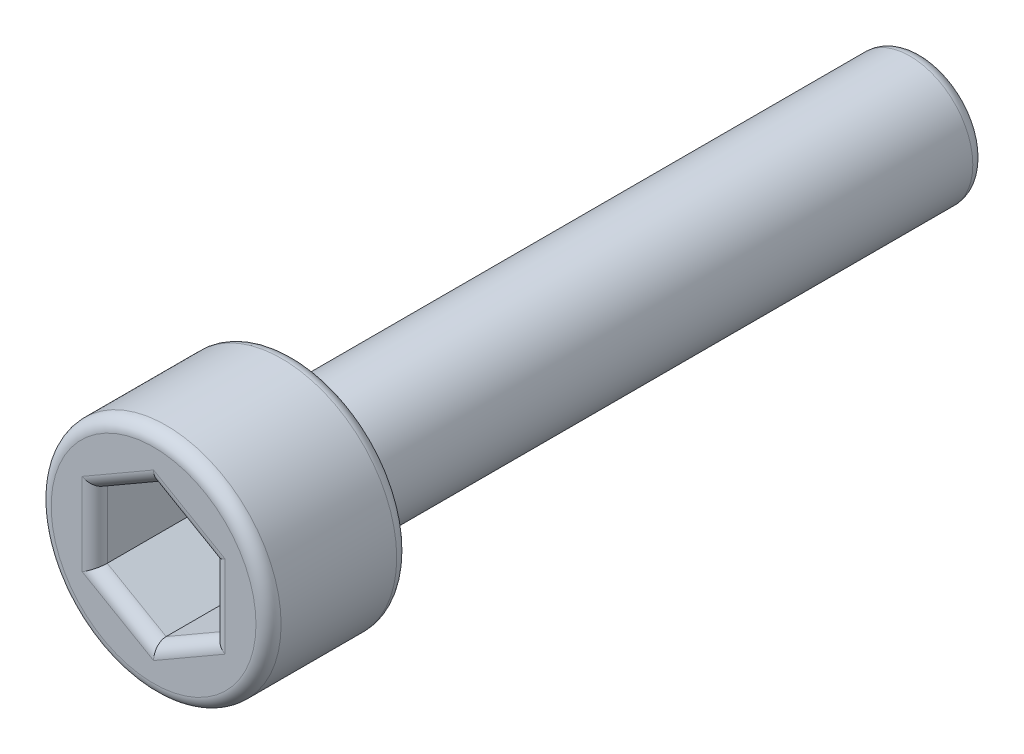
SolidWorks part; units mm, degrees
ref_plane "Front Plane" through (0, 0, 0) normal (0, 0, 1) x (1, 0, 0)
ref_plane "Top Plane" through (0, 0, 0) normal (0, 1, 0) x (1, 0, 0)
ref_plane "Right Plane" through (0, 0, 0) normal (1, 0, 0) x (0, 0, -1)
sketch "Sketch1" plane through (0, 0, 0) normal (0, 0, 1) x (1, 0, 0)
  circle A0 centre (0, 0) radius 1.27
  dimension "D1" = 2.54
extrude "Extrude1" add sketch "Sketch1" along normal blind 12.7
sketch "Sketch2" plane through (0, 0, 12.7) normal (0, 0, 1) x (1, 0, 0)
  circle A0 centre (0, 0) radius 2.3241
  dimension "D1" = 4.6482
extrude "Extrude2" add sketch "Sketch2" along normal blind 2.8448
sketch "Sketch3" plane through (0, 0, 15.5448) normal (0, 0, 1) x (1, 0, 0)
  line L1 (0, -1.3748) -> (1.1906, -0.6874)
  line L2 (1.1906, -0.6874) -> (1.1906, 0.6874)
  line L3 (1.1906, 0.6874) -> (0, 1.3748)
  line L4 (0, 1.3748) -> (-1.1906, 0.6874)
  line L5 (-1.1906, 0.6874) -> (-1.1906, -0.6874)
  line L6 (-1.1906, -0.6874) -> (0, -1.3748)
  circle A0 centre (0, 0) radius 1.1906 construction
  dimension "D1" = 2.3813
extrude "Cut-Extrude1" cut sketch "Sketch3" against normal blind 2.032
fillet "Fillet1" radius 0.254 6 edges at (-0.5953, -1.0311, 15.5448) (0.5953, -1.0311, 15.5448) (1.1906, 0, 15.5448) (0.5953, 1.0311, 15.5448) (-0.5953, 1.0311, 15.5448) (-1.1906, 0, 15.5448)
fillet "Fillet2" radius 0.254 2 edges at (2.3241, 0, 12.7) (2.3241, 0, 15.5448)
fillet "Fillet3" radius 0.254 1 edges at (1.27, 0, 0)
